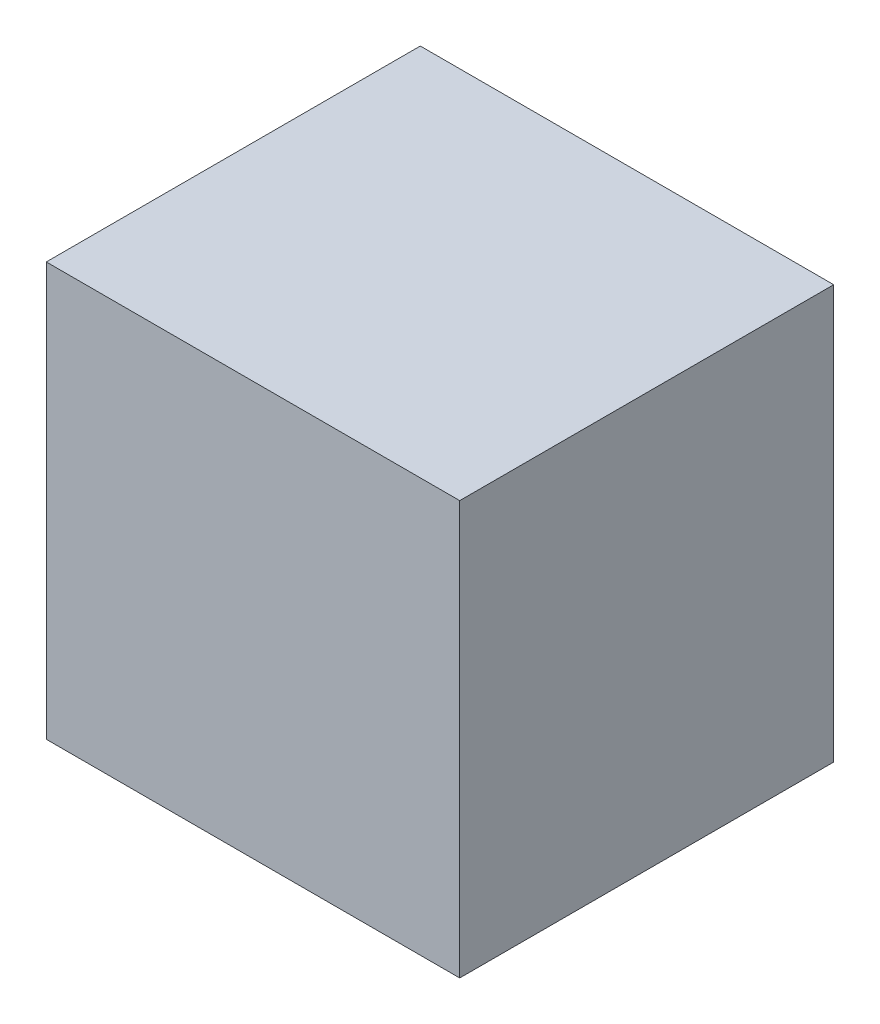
SolidWorks part; units mm, degrees
ref_plane "Front" through (0, 0, 0) normal (0, 0, 1) x (1, 0, 0)
ref_plane "Top" through (0, 0, 0) normal (0, 1, 0) x (1, 0, 0)
ref_plane "Right" through (0, 0, 0) normal (1, 0, 0) x (0, 0, -1)
sketch "Sketch1" plane through (0, 0, 0) normal (0, 0, 1) x (1, 0, 0)
  line L1 (0, 0) -> (57.0395, 0)
  line L2 (0, 0) -> (0, 57.0395)
  line L3 (0, 57.0395) -> (57.0395, 57.0395)
  line L4 (57.0395, 0) -> (57.0395, 57.0395)
extrude "Extrude1" add sketch "Sketch1" along normal mid plane 51.5986
